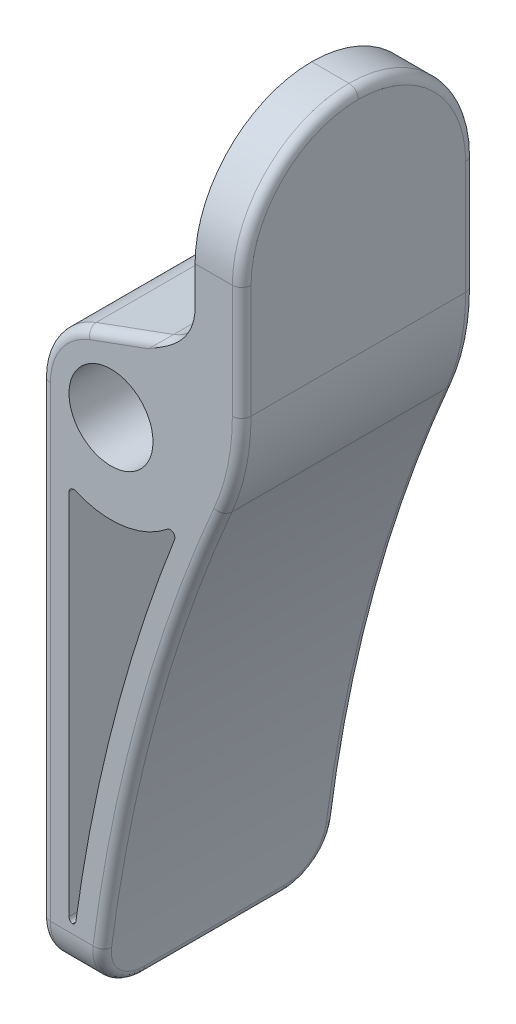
SolidWorks part; units mm, degrees
ref_plane "Front Plane" through (0, 0, 0) normal (0, 0, 1) x (1, 0, 0)
ref_plane "Top Plane" through (0, 0, 0) normal (0, 1, 0) x (1, 0, 0)
ref_plane "Right Plane" through (0, 0, 0) normal (1, 0, 0) x (0, 0, -1)
sketch "Sketch1" plane through (0, 0, 0) normal (0, 0, 1) x (1, 0, 0)
  line L0 (-10.989, -14.7174) -> (-22.5721, -18.9525)
  line L4 (-10.989, -5) -> (-10.989, 5)
  line L5 (-10.989, -14.7174) -> (-10.989, 5.2826)
  line L6 (-5.989, 5.2826) -> (-5.989, -24.7174)
  line L8 (-27.4967, -25.9965) -> (-27.4967, -80.9965)
  line L9 (-27.4967, -80.9965) -> (-21.4967, -80.9965)
  line L11 (-10.989, 5.2826) -> (-5.989, 5.2826)
  arc A0 (-5.989, -24.7174) -> (-21.4967, -80.9965) centre (152.6061, -98.6944) ccw
  circle A1 centre (-19.9967, -25.9965) radius 4.5
  arc A2 (-22.5721, -18.9525) -> (-27.4967, -25.9965) centre (-19.9967, -25.9965) ccw
  circle A4 centre (-19.9967, -25.9965) radius 7.5 construction
  point P4 (43.6357, -80.9965)
  dimension "D7" = 9
  dimension "D8" = 30
  dimension "D9" = 350
  dimension "D2" = 1
  dimension "D3" = 5
  dimension "D4" = 6
  dimension "D5" = 20
  dimension "D6" = 55
  dimension "D1" = 3
extrude "Boss-Extrude1" add sketch "Sketch1" along normal mid plane 25
fillet "Fillet1" radius 25 1 edges at (-5.989, -24.7174, 0)
fillet "Fillet2" radius 5 2 edges at (-24.4967, -80.9965, -12.5) (-24.4967, -80.9965, 12.5)
fillet "Fillet6" radius 1 9 edges at (-16.7805, -16.8349, -12.5) (-26.1434, -21.6991, -12.5) (-16.7805, -16.8349, 12.5) (-26.1434, -21.6991, 12.5) (-27.4967, -50.9965, 12.5) (-27.4967, -79.532, 11.0355) (-27.4967, -80.9965, 0) (-27.4967, -79.532, -11.0355) (-27.4967, -50.9965, -12.5)
fillet "Fillet8" radius 5 3 edges at (-10.989, -15.0292, 12.2071) (-10.989, -15.0292, -12.2071) (-10.989, -14.7174, 0)
fillet "Fillet10" radius 12.5 2 edges at (-8.489, 5.2826, -12.5) (-8.489, 5.2826, 12.5)
fillet "Fillet11" radius 1 11 edges at (-5.989, 1.6215, -8.8388) (-5.989, -13.2922, -12.5) (-5.989, -13.2922, 12.5) (-5.989, 1.6215, 8.8388) (-6.507, -24.4298, -12.5) (-16.1022, -52.1918, -12.5) (-21.3829, -79.9111, -10.6105) (-21.4967, -80.9965, 0) (-21.2974, -79.1357, 11.3917) (-16.1022, -52.1918, 12.5) (-6.507, -24.4298, 12.5)
sketch "Sketch2" plane through (0, 0, 12.5) normal (0, 0, 1) x (1, 0, 0)
  line L2 (-24.4967, -25.9965) -> (-24.4967, -75.9965)
  line L3 (-24.4967, -34.3631) -> (-24.4967, -75.0714)
  line L5 (-23.8194, -75.0714) -> (-24.4967, -75.0714)
  arc A4 (-10.7935, -28.093) -> (-23.9074, -75.7385) centre (152.6061, -98.6944) ccw
  arc A5 (-12.1829, -31.3997) -> (-23.8194, -75.0714) centre (152.6061, -98.6944) ccw
  circle A6 centre (-19.9967, -25.9965) radius 9.5
  arc A7 (-24.4967, -34.3631) -> (-12.1829, -31.3997) centre (-19.9967, -25.9965) ccw
  point P2 (-15.1731, -31.7396)
  dimension "D2" = 5
  dimension "D1" = 2
  dimension "D4" = 2
extrude "Cut-Extrude2" cut sketch "Sketch2" against normal up to surface (25 mm away)
fillet "Fillet14" radius 0.5 4 edges at (-12.1829, -31.3997, 0) (-24.4967, -34.3631, 0) (-23.8194, -75.0714, 0) (-24.4967, -75.0714, 0)
